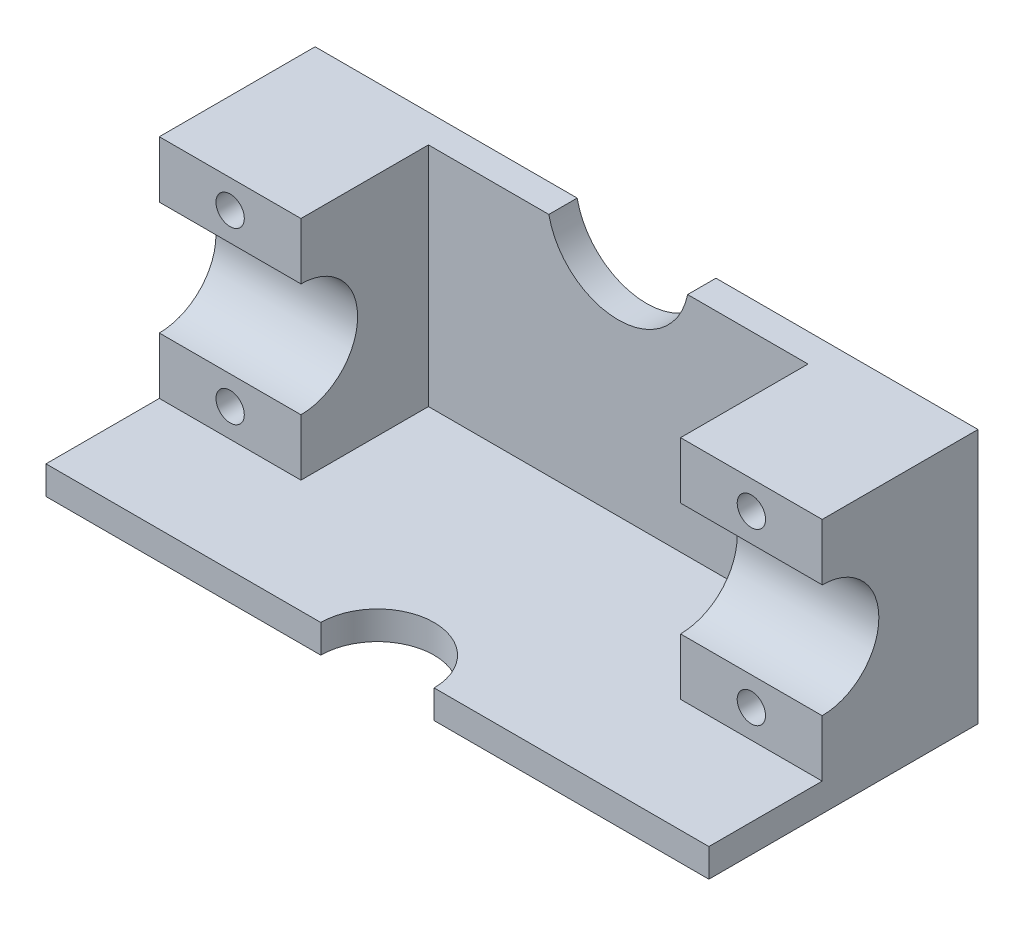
SolidWorks part; units mm, degrees
ref_plane "Plan de face" through (0, 0, 0) normal (0, 0, 1) x (1, 0, 0)
ref_plane "Plan de dessus" through (0, 0, 0) normal (0, 1, 0) x (1, 0, 0)
ref_plane "Plan de droite" through (0, 0, 0) normal (1, 0, 0) x (0, 0, -1)
sketch "Esquisse2" plane through (0, 0, 0) normal (0, 0, 1) x (1, 0, 0)
  line L0 (0, 2.9783) -> (0, -3.0897) construction
  line L1 (-23.4, 8) -> (-4.899, 8)
  line L2 (-23.4, 8) -> (-23.4, -8)
  line L3 (-23.4, -8) -> (23.4, -8)
  line L4 (23.4, 8) -> (23.4, -8)
  line L5 (-2.7399, 0) -> (2.8271, 0) construction
  line L6 (4.899, 8) -> (23.4, 8)
  arc A0 (-4.899, 8) -> (4.899, 8) centre (0, 9) ccw
  point P11 (0, 0)
  point P12 (0, 9.3496)
  dimension "D3" = 10
  dimension "D1" = 16
  dimension "D2" = 46.8
  dimension "D4" = 9
extrude "Boss.-Extru.1" add sketch "Esquisse2" along normal blind 2
sketch "Esquisse5" plane through (0, 0, 2) normal (0, 0, 1) x (1, 0, 0)
  line L0 (-23.4, -8) -> (23.4, -8) construction
  line L1 (-23.4, 8) -> (-13.4, 8)
  line L2 (-23.4, 8) -> (-23.4, -8)
  line L3 (-23.4, -8) -> (-13.4, -8)
  line L4 (-13.4, 8) -> (-13.4, -8)
  line L5 (0, 3.7784) -> (0, -3.297) construction
  line L6 (13.4, 8) -> (13.4, -8)
  line L7 (23.4, -8) -> (13.4, -8)
  line L8 (23.4, 8) -> (23.4, -8)
  line L9 (23.4, 8) -> (13.4, 8)
  dimension "D1" = 10
extrude "Boss.-Extru.2" add sketch "Esquisse5" along normal blind 17
sketch "Esquisse6" plane through (-23.4, 0, 0) normal (-1, 0, 0) x (0, 0, 1)
  line L1 (0, 8) -> (0, -8) construction
  circle A0 centre (11, 0) radius 4
  dimension "D1" = 8
  dimension "D2" = 11
extrude "Enlèv. mat.-Extru.1" cut sketch "Esquisse6" against normal blind 49
sketch "Esquisse7" plane through (0, -8, 0) normal (0, -1, 0) x (1, 0, 0)
  line L0 (4, 19) -> (23.4, 19)
  line L1 (-23.4, 19) -> (-4, 19)
  line L2 (-23.4, 19) -> (-23.4, 0)
  line L3 (-23.4, 0) -> (23.4, 0)
  line L4 (23.4, 19) -> (23.4, 0)
  arc A0 (-4, 19) -> (4, 19) centre (0, 19) ccw
  point P7 (0, 19)
  point P8 (0, 0)
  point P9 (0, 0)
  point P10 (0, 19)
  dimension "D1" = 8
extrude "Boss.-Extru.4" add sketch "Esquisse7" along normal blind 2
sketch "Esquisse11" plane through (-23.4, 0, 0) normal (-1, 0, 0) x (0, 0, 1)
  line L0 (19, 8) -> (2.5, -8)
  line L2 (19, 8) -> (19, -8)
  line L4 (2.5, -8) -> (19, -8)
  line L5 (19, -10) -> (0, -10) construction
  dimension "D1" = 2
extrude "Enlèv. mat.-Extru.5" [suppressed] cut sketch "Esquisse11" against normal blind 65
sketch "Esquisse8" plane through (0, 0, 19) normal (0, 0, 1) x (1, 0, 0)
  line L0 (23.4, -10) -> (23.4, 8) construction
  line L1 (-23.4, 8) -> (-13.4, 8)
  line L2 (-23.4, 8) -> (-23.4, -8)
  line L3 (-23.4, -8) -> (-13.4, -8)
  line L4 (-13.4, 8) -> (-13.4, -8)
  line L5 (13.4, 8) -> (23.4, 8)
  line L6 (13.4, 8) -> (13.4, -8)
  line L7 (13.4, -8) -> (23.4, -8)
  line L8 (23.4, 8) -> (23.4, -8)
extrude "Enlèv. mat.-Extru.2" cut sketch "Esquisse8" against normal blind 8
sketch "Esquisse10" plane through (0, 0, 11) normal (0, 0, 1) x (1, 0, 0)
  line L0 (-18.4, 8) -> (-18.4, -10.7948) construction
  line L1 (-13.4, 8) -> (-23.4, 8) construction
  line L2 (-24.5954, 6) -> (26.1356, 6) construction
  line L3 (-25.4137, -6) -> (26.1356, -6) construction
  line L4 (0, 12.8363) -> (0, -17.3831) construction
  line L5 (18.4, 8) -> (18.4, -10.7948) construction
  line L7 (-23.4, -8) -> (-13.4, -8) construction
  line L8 (-23.4, 8) -> (-23.4, 4) construction
  circle A0 centre (-18.4, 6) radius 1
  circle A1 centre (-18.4, -6) radius 1
  circle A2 centre (18.4, -6) radius 1
  circle A3 centre (18.4, 6) radius 1
  point P25 (-18.4, 6)
  point P27 (-18.2613, 6.8112)
  dimension "D1" = 2
  dimension "D2" = 2
  dimension "D3" = 2
  dimension "D4" = 2
  dimension "D5" = 5
extrude "Enlèv. mat.-Extru.3" cut sketch "Esquisse10" against normal blind 13
